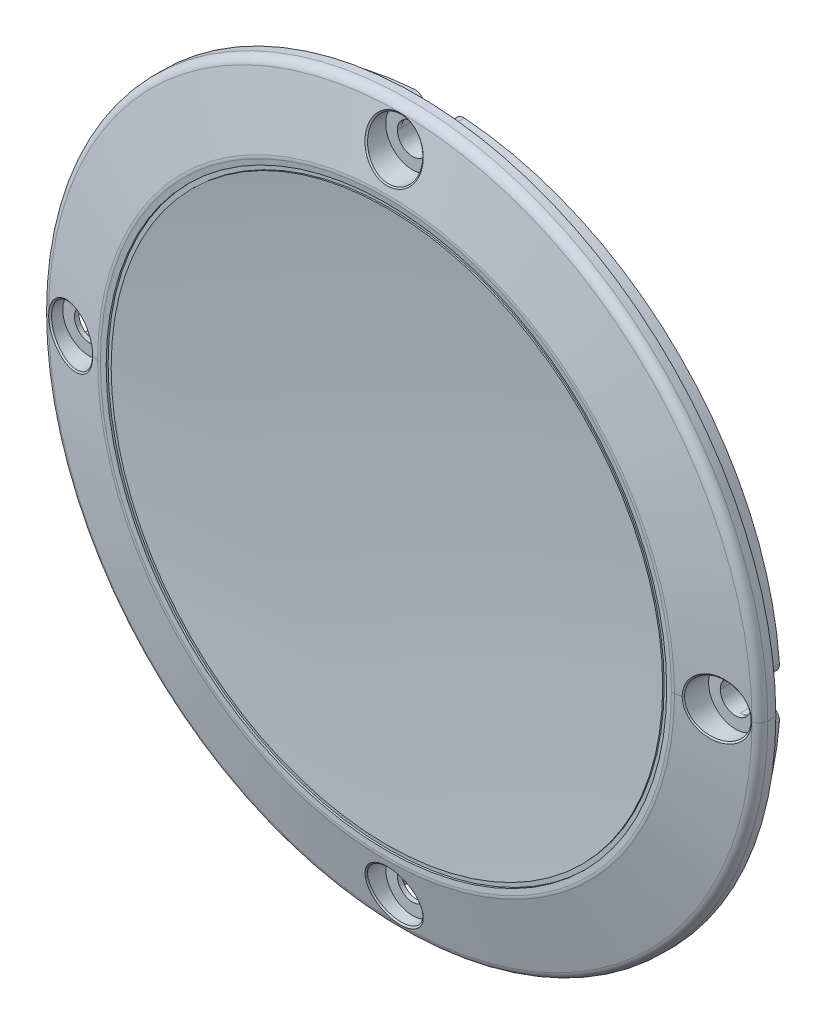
SolidWorks part; units mm, degrees
ref_plane "前视基准面" through (0, 0, 0) normal (0, 0, 1) x (1, 0, 0)
ref_plane "上视基准面" through (0, 0, 0) normal (0, 1, 0) x (1, 0, 0)
ref_plane "右视基准面" through (0, 0, 0) normal (1, 0, 0) x (0, 0, -1)
imported_body "输入1"
other "删除面1"
sketch "草图1" plane through (0, 0, 20) normal (0, 0, 1) x (1, 0, 0)
  circle A0 centre (0, 36) radius 3
  circle A1 centre (36, 0) radius 3
  circle A2 centre (0, -36) radius 3
  circle A3 centre (-36, 0) radius 3
extrude "切除-拉伸1" cut sketch "草图1" along normal blind 10
